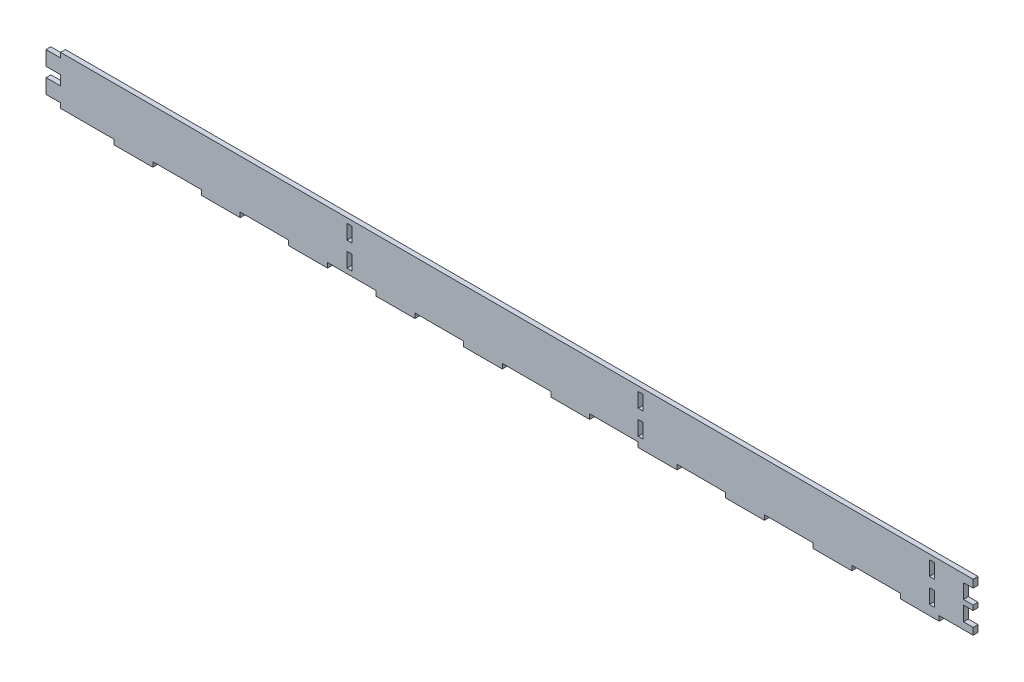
SolidWorks part; units mm, degrees
ref_plane "Front Plane" through (0, 0, 0) normal (0, 0, 1) x (1, 0, 0)
ref_plane "Top Plane" through (0, 0, 0) normal (0, 1, 0) x (1, 0, 0)
ref_plane "Right Plane" through (0, 0, 0) normal (1, 0, 0) x (0, 0, -1)
sketch "Model" plane through (0, 0, 0) normal (0, 0, 1) x (1, 0, 0)
  line L0 (-590, 20) -> (-590, 5)
  line L1 (-590, 5) -> (-585, 5)
  line L2 (-585, 5) -> (-585, 20)
  line L3 (-585, 20) -> (-590, 20)
  line L4 (610, 20) -> (610, 5)
  line L5 (610, 5) -> (615, 5)
  line L6 (615, 5) -> (615, 20)
  line L7 (615, 20) -> (610, 20)
  line L8 (-590, 45) -> (-590, 30)
  line L9 (-590, 30) -> (-585, 30)
  line L10 (-585, 30) -> (-585, 45)
  line L11 (-585, 45) -> (-590, 45)
  line L12 (610, 45) -> (610, 30)
  line L13 (610, 30) -> (615, 30)
  line L14 (615, 30) -> (615, 45)
  line L15 (615, 45) -> (610, 45)
  line L16 (310, 20) -> (310, 5)
  line L17 (310, 5) -> (315, 5)
  line L18 (315, 5) -> (315, 20)
  line L19 (315, 20) -> (310, 20)
  line L20 (310, 45) -> (310, 30)
  line L21 (310, 30) -> (315, 30)
  line L22 (315, 30) -> (315, 45)
  line L23 (315, 45) -> (310, 45)
  line L24 (10, 20) -> (10, 5)
  line L25 (10, 5) -> (15, 5)
  line L26 (15, 5) -> (15, 20)
  line L27 (15, 20) -> (10, 20)
  line L28 (10, 45) -> (10, 30)
  line L29 (10, 30) -> (15, 30)
  line L30 (15, 30) -> (15, 45)
  line L31 (15, 45) -> (10, 45)
  line L32 (-290, 20) -> (-290, 5)
  line L33 (-290, 5) -> (-285, 5)
  line L34 (-285, 5) -> (-285, 20)
  line L35 (-290, 45) -> (-290, 30)
  line L36 (-290, 30) -> (-285, 30)
  line L37 (-285, 30) -> (-285, 45)
  line L38 (-285, 45) -> (-290, 45)
  line L39 (-285, 20) -> (-290, 20)
  line L40 (-885, 0) -> (-830, 0)
  line L41 (-830, 0) -> (-830, -5)
  line L42 (-830, -5) -> (-790, -5)
  line L43 (-790, -5) -> (-790, 0)
  line L44 (-790, 0) -> (-740, 0)
  line L45 (-740, 0) -> (-740, -5)
  line L46 (-740, -5) -> (-700, -5)
  line L47 (-700, -5) -> (-700, 0)
  line L48 (-700, 0) -> (-650, 0)
  line L49 (-650, 0) -> (-650, -5)
  line L50 (-650, -5) -> (-610, -5)
  line L51 (-610, -5) -> (-610, 0)
  line L52 (-610, 0) -> (-560, 0)
  line L53 (-560, 0) -> (-560, -5)
  line L54 (-560, -5) -> (-520, -5)
  line L55 (-520, -5) -> (-520, 0)
  line L56 (-520, 0) -> (-470, 0)
  line L57 (-470, 0) -> (-470, -5)
  line L58 (-470, -5) -> (-430, -5)
  line L59 (-430, -5) -> (-430, 0)
  line L60 (-430, 0) -> (-380, 0)
  line L61 (-380, 0) -> (-380, -5)
  line L62 (-380, -5) -> (-340, -5)
  line L63 (-340, -5) -> (-340, 0)
  line L64 (-340, 0) -> (-290, 0)
  line L65 (-290, 0) -> (-290, -5)
  line L66 (-290, -5) -> (-250, -5)
  line L67 (-250, -5) -> (-250, 0)
  line L68 (-250, 0) -> (-200, 0)
  line L69 (-200, 0) -> (-200, -5)
  line L70 (-200, -5) -> (-160, -5)
  line L71 (-160, -5) -> (-160, 0)
  line L72 (-160, 0) -> (-110, 0)
  line L73 (-110, 0) -> (-110, -5)
  line L74 (-110, -5) -> (-70, -5)
  line L75 (-70, -5) -> (-70, 0)
  line L76 (-70, 0) -> (-20, 0)
  line L77 (-20, 0) -> (-20, -5)
  line L78 (-20, -5) -> (20, -5)
  line L79 (20, -5) -> (20, 0)
  line L80 (20, 0) -> (70, 0)
  line L81 (70, 0) -> (70, -5)
  line L82 (70, -5) -> (110, -5)
  line L83 (110, -5) -> (110, 0)
  line L84 (110, 0) -> (160, 0)
  line L85 (160, 0) -> (160, -5)
  line L86 (160, -5) -> (200, -5)
  line L87 (200, -5) -> (200, 0)
  line L88 (200, 0) -> (250, 0)
  line L89 (250, 0) -> (250, -5)
  line L90 (250, -5) -> (290, -5)
  line L91 (290, -5) -> (290, 0)
  line L92 (290, 0) -> (340, 0)
  line L93 (340, 0) -> (340, -5)
  line L94 (340, -5) -> (380, -5)
  line L95 (380, -5) -> (380, 0)
  line L96 (380, 0) -> (430, 0)
  line L97 (430, 0) -> (430, -5)
  line L98 (430, -5) -> (470, -5)
  line L99 (470, -5) -> (470, 0)
  line L100 (470, 0) -> (520, 0)
  line L101 (520, 0) -> (520, -5)
  line L102 (520, -5) -> (560, -5)
  line L103 (560, -5) -> (560, 0)
  line L104 (560, 0) -> (610, 0)
  line L105 (610, 0) -> (610, -5)
  line L106 (610, -5) -> (650, -5)
  line L107 (650, -5) -> (650, 0)
  line L108 (650, 0) -> (700, 0)
  line L109 (700, 0) -> (700, -5)
  line L110 (700, -5) -> (740, -5)
  line L111 (740, -5) -> (740, 0)
  line L112 (740, 0) -> (790, 0)
  line L113 (790, 0) -> (790, -5)
  line L114 (790, -5) -> (830, -5)
  line L115 (830, -5) -> (830, 0)
  line L116 (830, 0) -> (885, 0)
  line L117 (885, 0) -> (885, 5)
  line L118 (885, 5) -> (900, 5)
  line L119 (900, 5) -> (900, 20)
  line L120 (900, 20) -> (885, 20)
  line L121 (885, 20) -> (885, 30)
  line L122 (885, 30) -> (900, 30)
  line L123 (900, 30) -> (900, 45)
  line L124 (900, 45) -> (885, 45)
  line L125 (885, 45) -> (885, 50)
  line L126 (885, 50) -> (-885, 50)
  line L127 (-885, 50) -> (-885, 45)
  line L128 (-885, 45) -> (-900, 45)
  line L129 (-900, 45) -> (-900, 30)
  line L130 (-900, 30) -> (-885, 30)
  line L131 (-885, 30) -> (-885, 20)
  line L132 (-885, 20) -> (-900, 20)
  line L133 (-900, 20) -> (-900, 5)
  line L134 (-900, 5) -> (-885, 5)
  line L135 (-885, 5) -> (-885, 0)
extrude "Boss-Extrude1" add sketch "Model" along normal blind 5 contours L126 L127 L128 L129 L130 L131 L132 L133 L134 L135 L40 L41 L42 L43 L44 L45 L46 L47 L48 L49 L50 L51 L52 L53 L54 L55 L56 L57 L58 L59 L60 L61 L62 L63 L64 L65 L66 L67 L68 L69 L70 L71 L72 L73 L74 L75 L76 L77 L78 L79 L80 L81 L82 L83 L84 L85 L86 L87 L88 L89 L90 L91 L92 L93 L94 L95 L96 L97 L98 L99 L100 L101 L102 L103 L104 L105 L106 L107 L108 L109 L110 L111 L112 L113 L114 L115 L116 L117 L118 L119 L120 L121 L122 L123 L124 L125
sketch "Sketch1" plane through (0, 0, 5) normal (0, 0, 1) x (1, 0, 0)
  line L0 (55, 50) -> (55, 42)
  line L1 (885, 50) -> (-885, 50) construction
  line L2 (55, 42) -> (45, 42)
  line L3 (45, 42) -> (45, 27)
  line L4 (45, 27) -> (55, 27)
  line L5 (55, 27) -> (55, 22)
  line L6 (55, 22) -> (45, 22)
  line L7 (45, 22) -> (45, 7)
  line L8 (45, 7) -> (55, 7)
  line L9 (55, 7) -> (55, 0)
  line L10 (20, 0) -> (70, 0) construction
  line L11 (55, 50) -> (1126.3018, 127.7544)
  line L12 (1126.3018, 127.7544) -> (770.7619, -361.9579)
  line L13 (770.7619, -361.9579) -> (55, 0)
  point P12 (770.7619, -361.9579)
  dimension "D1" = 5
  dimension "D2" = 10
  dimension "D3" = 10
  dimension "D4" = 10
  dimension "D5" = 10
  dimension "D6" = 8
  dimension "D7" = 15
  dimension "D8" = 15
  dimension "D9" = 35
extrude "Cut-Extrude1" cut sketch "Sketch1" against normal through all
